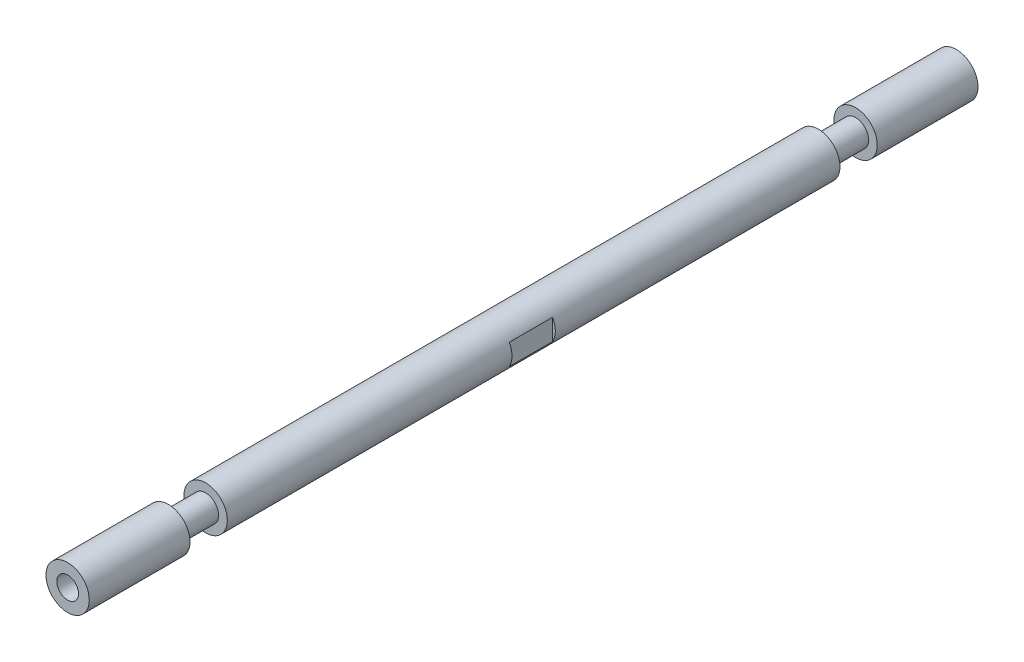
SolidWorks part; units mm, degrees
ref_plane "Plane1" through (0, 0, 0) normal (0, 0, 1) x (1, 0, 0)
ref_plane "Plane2" through (0, 0, 0) normal (0, 1, 0) x (1, 0, 0)
ref_plane "Plane3" through (0, 0, 0) normal (1, 0, 0) x (0, 0, -1)
sketch "Sketch1" plane through (0, 0, 0) normal (0, 0, 1) x (1, 0, 0)
  circle A0 centre (0, 0) radius 6.35
  dimension "D1" = 12.7
extrude "Base-Extrude" add sketch "Sketch1" along normal blind 260.477
ref_plane "Plane4" through (0, 0, 230.9495) normal (0, 0, 1) x (1, 0, 0)
sketch "Sketch2" plane through (0, 0, 230.9495) normal (0, 0, 1) x (1, 0, 0)
  circle A0 centre (0, 0) radius 7.0352
  circle A1 centre (0, 0) radius 3.81
  dimension "D1" = 7.62
extrude "Cut-Extrude1" cut sketch "Sketch2" against normal blind 10.922
ref_plane "Plane5" through (0, 0, 29.5275) normal (0, 0, -1) x (-1, 0, 0)
sketch "Sketch3" plane through (0, 0, 29.5275) normal (0, 0, -1) x (-1, 0, 0)
  circle A0 centre (0, 0) radius 6.7797
  circle A1 centre (0, 0) radius 3.8299
  dimension "D1" = 7.6598
extrude "Cut-Extrude2" cut sketch "Sketch3" against normal blind 10.922
hole_wizard "1/4-20 Tapped Hole 1" positions "Sketch5" profile "Sketch4" legacy
sketch "Sketch5" plane through (-1.1421, 1.9355, 0) normal (0, 0, -1) x (-1, 0, 0)
  point P0 (-1.1452, -1.9468)
sketch "Sketch4" plane through (0.0031, -0.0113, 0) normal (1, 0, 0) x (0, 1, 0)
  line L0 (0, 0) -> (0, 25.4)
  line L1 (0, 25.4) -> (2.5527, 23.8662)
  line L2 (2.5527, 23.8662) -> (2.5527, 0.0025)
  line L3 (2.5527, 0.0025) -> (2.5527, 0)
  line L4 (2.5527, 0) -> (0, 0)
hole_wizard "1/4-20 Tapped Hole 4" positions "Sketch11" profile "Sketch10" legacy
sketch "Sketch11" plane through (0.1851, 0.0793, 260.477) normal (0, 0, 1) x (1, 0, 0)
  point P0 (-0.1706, -0.0747)
sketch "Sketch10" plane through (0.0145, 0.0046, 260.477) normal (1, 0, 0) x (0, -1, 0)
  line L0 (0, 0) -> (0, 12.7)
  line L1 (0, 12.7) -> (2.5527, 11.1662)
  line L2 (2.5527, 11.1662) -> (2.5527, 11.43)
  line L3 (2.5527, 11.43) -> (3.175, 11.43)
  line L4 (3.175, 11.43) -> (3.175, 0.0025)
  line L5 (3.175, 0.0025) -> (3.175, 0)
  line L6 (3.175, 0) -> (0, 0)
sketch "Sketch12" plane through (0, 0, 0) normal (0, 1, 0) x (1, 0, 0)
  line L1 (-6.35, -40.4495) -> (-6.35, -220.0275) construction
  line L2 (-6.35, -123.8885) -> (-5.5499, -123.8885)
  line L3 (-6.35, -130.2385) -> (-41.5005, -130.2385) construction
  line L5 (-6.35, -123.8885) -> (-6.35, -136.5885)
  line L6 (-6.35, -136.5885) -> (-5.5499, -136.5885)
  line L7 (-5.5499, -123.8885) -> (-5.5499, -136.5885)
  point P8 (-6.35, -130.2385)
  dimension "D1" = 12.7
  dimension "D2" = 0.8001
extrude "Cut-Extrude3" cut sketch "Sketch12" against normal mid plane 25.4
mirror "Mirror1" about plane through (0, 0, 0) normal (1, 0, 0) of "Cut-Extrude3"
